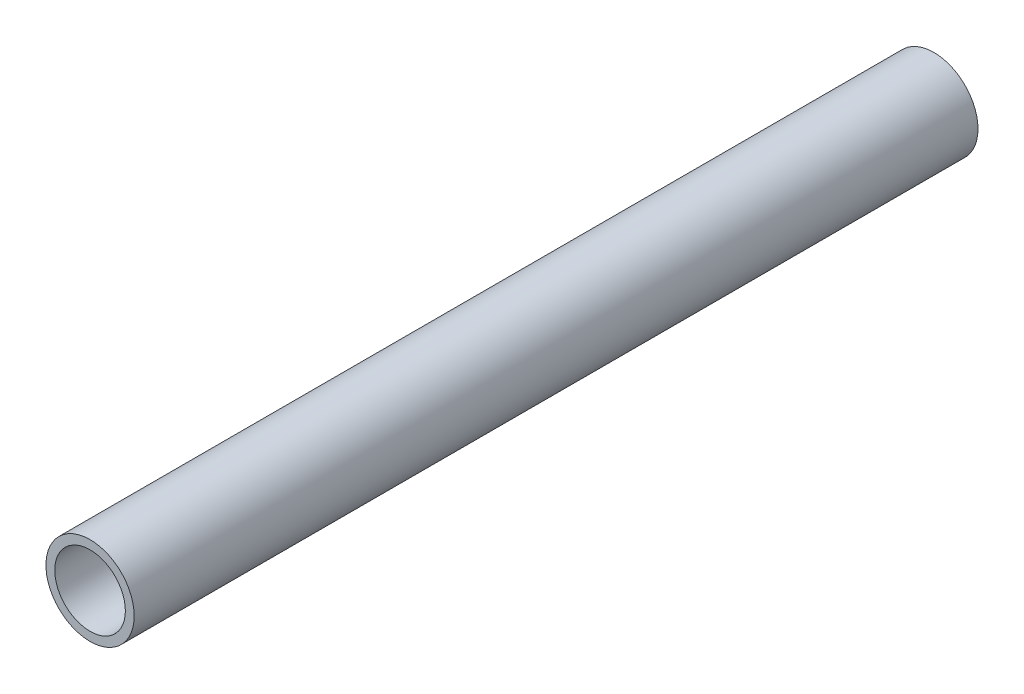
SolidWorks part; units mm, degrees
ref_plane "Face" through (0, 0, 0) normal (0, 0, 1) x (1, 0, 0)
ref_plane "Dessus" through (0, 0, 0) normal (0, 1, 0) x (1, 0, 0)
ref_plane "Droite" through (0, 0, 0) normal (1, 0, 0) x (0, 0, -1)
sketch "Esquisse1" plane through (0, 0, 0) normal (0, 0, 1) x (1, 0, 0)
  circle A0 centre (0, 0) radius 0.4
  circle A1 centre (0, 0) radius 0.5
  dimension "D1" = 0.8
  dimension "D2" = 1
extrude "Extrusion1" add sketch "Esquisse1" along normal blind 9.56
